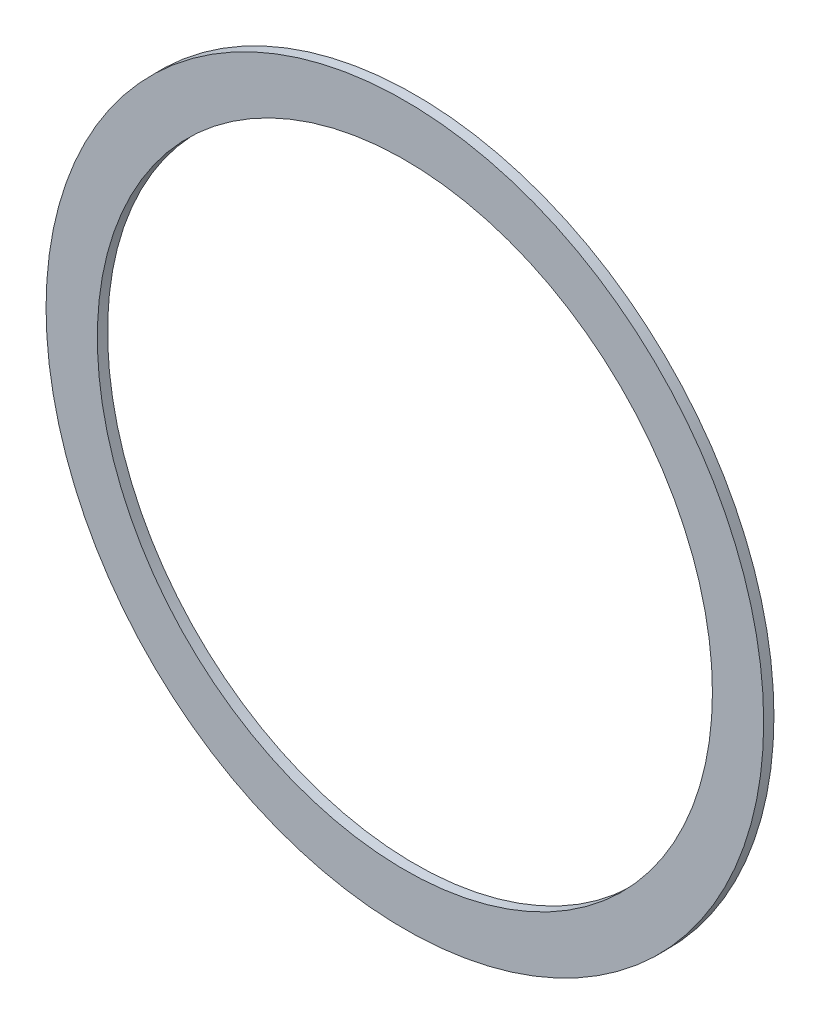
SolidWorks part; units mm, degrees
ref_plane "Plan de face" through (0, 0, 0) normal (0, 0, 1) x (1, 0, 0)
ref_plane "Plan de dessus" through (0, 0, 0) normal (0, 1, 0) x (1, 0, 0)
ref_plane "Plan de droite" through (0, 0, 0) normal (1, 0, 0) x (0, 0, -1)
sketch "Esquisse1" plane through (0, 0, 0) normal (0, 0, 1) x (1, 0, 0)
  circle A0 centre (0, 0) radius 17.5
  circle A1 centre (0, 0) radius 15
  dimension "D1" = 35
  dimension "D2" = 30
extrude "Extrusion1" add sketch "Esquisse1" along normal blind 0.5
